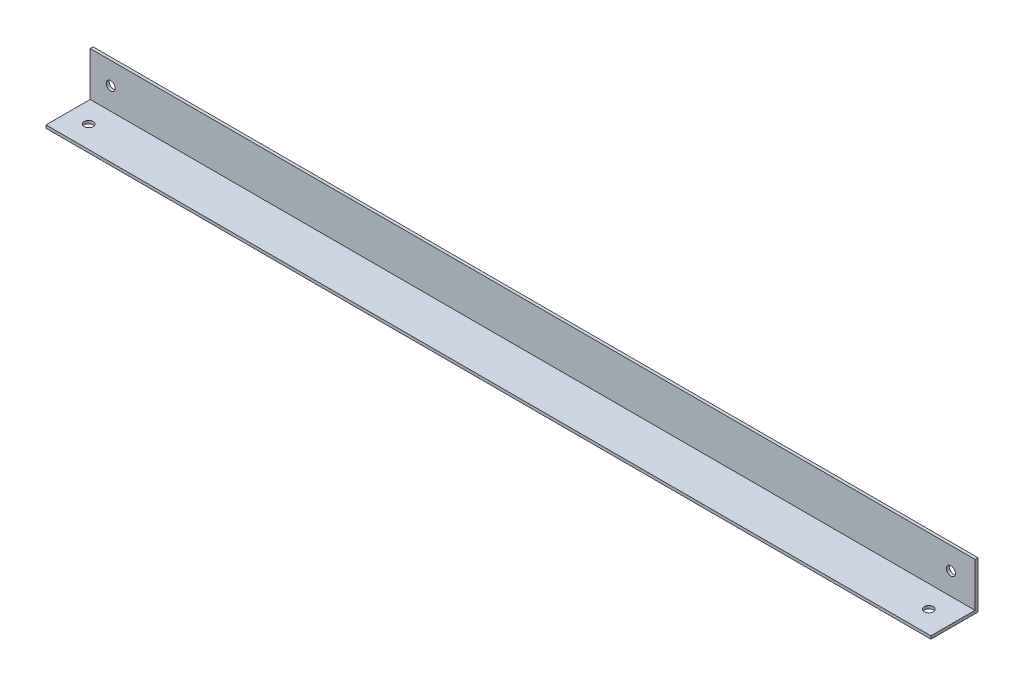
SolidWorks part; units mm, degrees
ref_plane "Front Plane" through (0, 0, 0) normal (1, 0, 0) x (0, 1, 0)
ref_plane "Top Plane" through (0, 0, 0) normal (0, 0, 1) x (0, 1, 0)
ref_plane "Right Plane" through (0, 0, 0) normal (0, 1, 0) x (-1, 0, 0)
sketch "Sketch1" plane through (0, 0, 0) normal (1, 0, 0) x (0, 1, 0)
  line L0 (0, 0) -> (25.4, 0)
  line L1 (0, 0) -> (0, 25.4)
  line L2 (1.5875, 1.5875) -> (1.5875, 25.4)
  line L3 (1.5875, 1.5875) -> (25.4, 1.5875)
  line L4 (25.4, 0) -> (25.4, 1.5875)
  line L5 (0, 25.4) -> (1.5875, 25.4)
  dimension "D1" = 25.4
  dimension "D2" = 1.5875
extrude "Boss-Extrude1" add sketch "Sketch1" along normal mid plane 477.52
sketch "Sketch2" plane through (0, 0, 0) normal (0, 1, 0) x (-1, 0, 0)
  line L0 (-238.76, 1.5875) -> (-238.76, 25.4) construction
  line L2 (238.76, 1.5875) -> (238.76, 25.4) construction
  circle A0 centre (-225.7425, 13.4937) radius 2.4257
  circle A1 centre (227.6475, 13.4937) radius 2.4257
  point P4 (-238.76, 13.4937)
extrude "Cut-Extrude1" cut sketch "Sketch2" along normal through all
ref_plane "Plane1" through (0, 0, 0) normal (0, -0.7071, 0.7071) x (0, -0.7071, -0.7071)
mirror "Mirror1" about plane through (0, 0, 0) normal (0, -0.7071, 0.7071) of "Cut-Extrude1"
equation "\"fdia\"=0.191"
equation "\"D1@Sketch2\"=\"fdia\""
